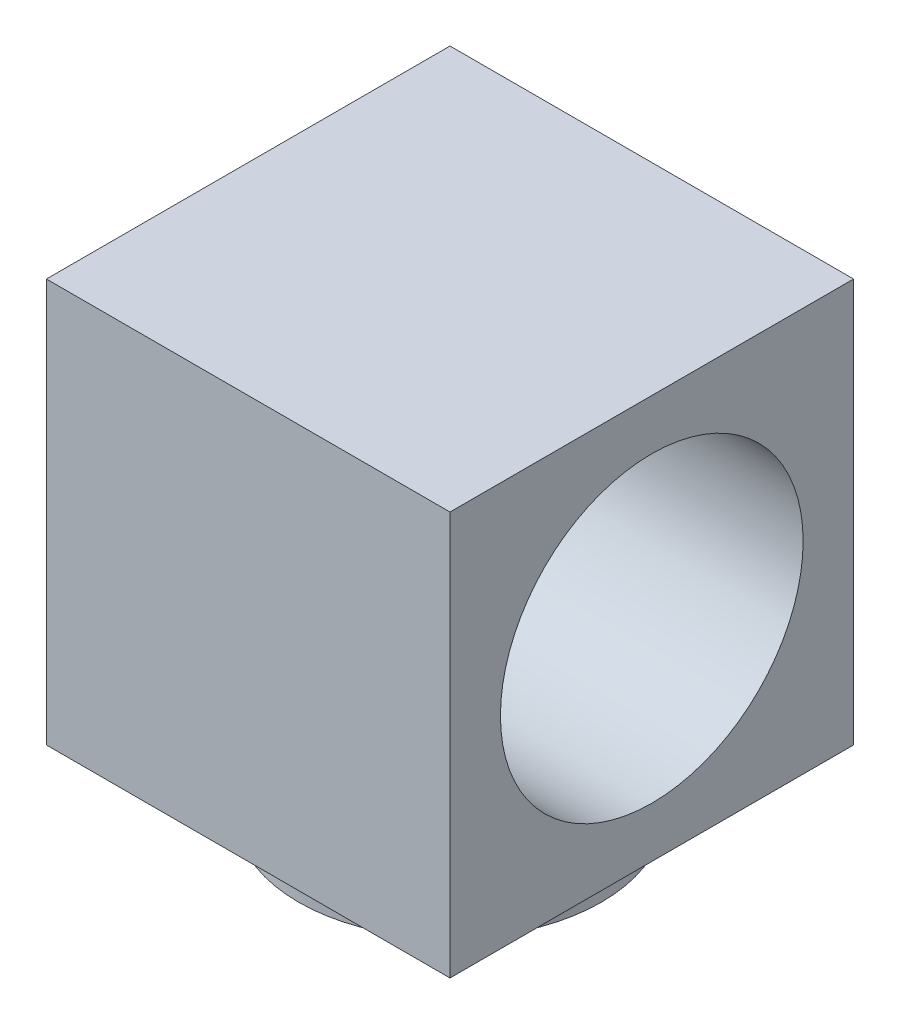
SolidWorks part; units mm, degrees
ref_plane "Front View" through (0, 0, 0) normal (0, 0, 1) x (1, 0, 0)
ref_plane "Upper View" through (0, 0, 0) normal (0, 1, 0) x (1, 0, 0)
ref_plane "Right View" through (0, 0, 0) normal (1, 0, 0) x (0, 0, -1)
sketch "Sketch1" plane through (0, 0, 0) normal (0, 0, 1) x (1, 0, 0)
  line L0 (-30.9041, 21.3474) -> (169.0959, 21.3474)
  line L1 (169.0959, 21.3474) -> (169.0959, -178.6526)
  line L2 (169.0959, -178.6526) -> (-30.9041, -178.6526)
  line L3 (-30.9041, -178.6526) -> (-30.9041, 21.3474)
extrude "Boss-Extrude1" add sketch "Sketch1" along normal blind 200
sketch "Sketch2" plane through (169.0959, 0, 0) normal (1, 0, 0) x (0, 0, -1)
  circle A0 centre (-100, -78.6526) radius 75
extrude "Cut-Extrude1" cut sketch "Sketch2" against normal blind 200
sketch "Sketch3" plane through (0, -178.6526, 0) normal (0, -1, 0) x (-1, 0, 0)
  circle A0 centre (-69.0959, -100) radius 75
  circle A1 centre (-69.0959, -100) radius 65
extrude "Boss-Extrude2" add sketch "Sketch3" along normal blind 30
